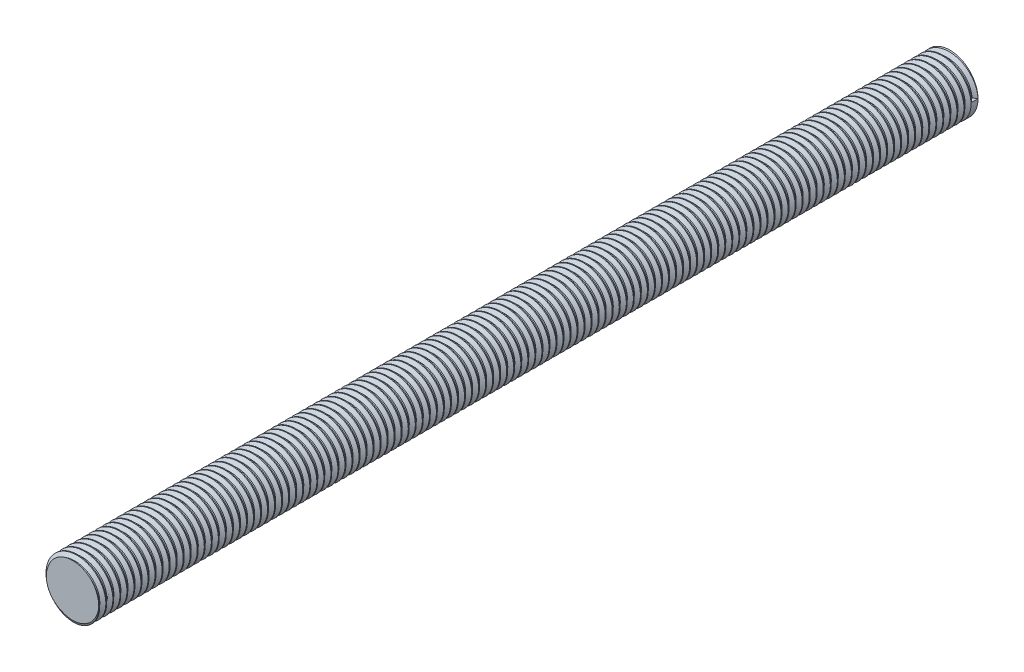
SolidWorks part; units mm, degrees
ref_plane "Front Plane" through (0, 0, 0) normal (0, 0, 1) x (1, 0, 0)
ref_plane "Top Plane" through (0, 0, 0) normal (0, 1, 0) x (1, 0, 0)
ref_plane "Right Plane" through (0, 0, 0) normal (1, 0, 0) x (0, 0, -1)
sketch "Sketch1" plane through (0, 0, 0) normal (0, 0, 1) x (1, 0, 0)
  circle A0 centre (0, 0) radius 3.2
  dimension "D1" = 6.4
extrude "Boss-Extrude1" add sketch "Sketch1" along normal blind 100
thread "Thread1" pitch 0.8 start angle 0, offset 0, length 100, pitch 0.8, diameter 6.4
ref_plane "Plane1" through (3.2, 0, 0) normal (0, -1, 0) x (1, 0, 0)
sketch "Thread Profile1" plane through (3.2, 0, 0) normal (0, -1, 0) x (1, 0, 0)
  line L0 (0, 0) -> (0, 0.8) construction
  line L11 (0, 0) -> (0, 0.7)
  line L12 (0, 0.7) -> (-0.433, 0.45)
  line L13 (-0.433, 0.45) -> (-0.433, 0.25)
  line L15 (-0.433, 0.25) -> (0, 0)
  line L17 (-0.433, 0.35) -> (0, 0.35) construction
  point P2 (0, 0)
  dimension "Pitch" = 0.8
  dimension "Profile_Angle" = 60
  dimension "Profile_Land" = 0.2
  dimension "Profile_Height" = 0.433
